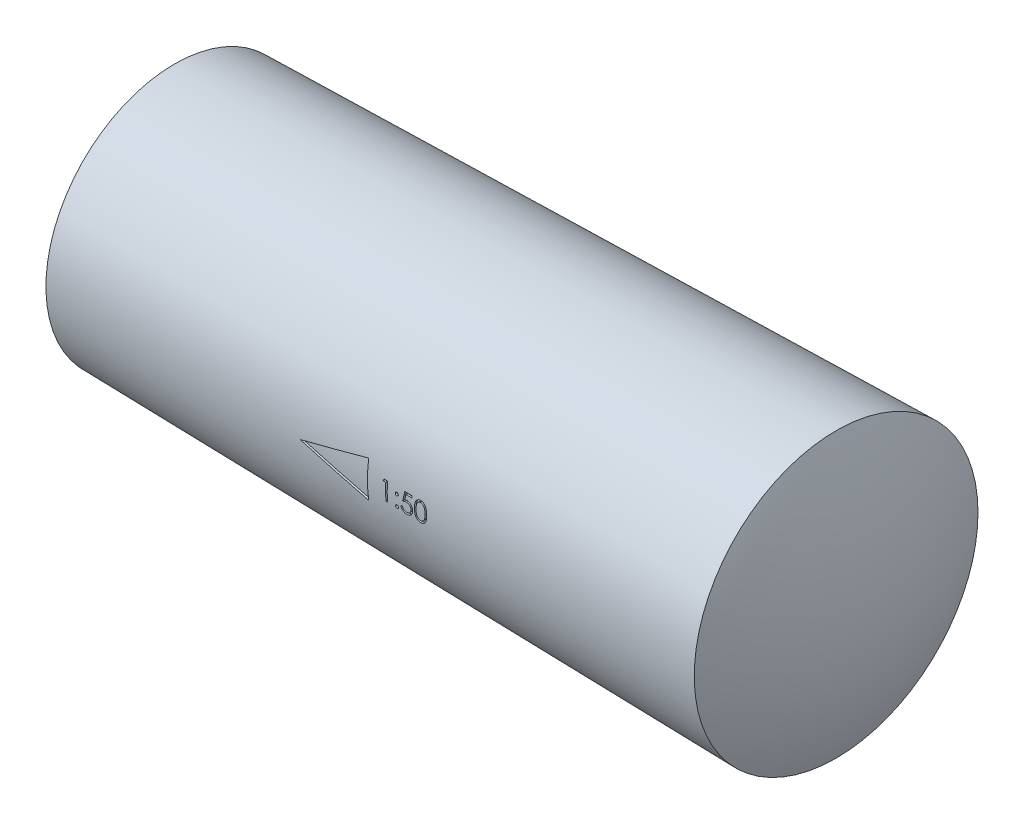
SolidWorks part; units mm, degrees
ref_plane "Front Plane" through (0, 0, 0) normal (0, 0, 1) x (1, 0, 0)
ref_plane "Top Plane" through (0, 0, 0) normal (0, 1, 0) x (1, 0, 0)
ref_plane "Right Plane" through (0, 0, 0) normal (1, 0, 0) x (0, 0, -1)
sketch "Sketch1" plane through (0, 0, 0) normal (1, 0, 0) x (0, 0, -1)
  circle A0 centre (0, 0) radius 7
  dimension "D1" = 14
extrude "Extrude1" add sketch "Sketch1" along normal mid plane 36
draft "Draft1" type of draft neutral plane draft angle 1.146 faces to draft 1 parameters "D1"=1.146
sketch "Sketch2" plane through (0, 0, 0) normal (0, 0, 1) x (1, 0, 0)
  line L0 (-18, 0) -> (-18, 7)
  line L1 (-18, 7) -> (-18, -7) construction
  line L2 (-18, 0) -> (-19.6, 0)
  line L3 (-19.6, 0) -> (-19.6, -7.36) construction
  line L4 (18, 0) -> (18, 7.72)
  line L5 (18, -7.72) -> (18, 7.72) construction
  line L6 (18, 0) -> (19.6, 0)
  line L7 (19.6, 0) -> (19.6, -7.36) construction
  line L8 (-18, -7) -> (18, -7.72) construction
  arc A0 (-19.6, 0) -> (-18, 7) centre (-3.4875, 0) cw
  arc A1 (19.6, 0) -> (18, 7.72) centre (0.1754, 0) ccw
  point P14 (0, -7.36)
revolve "Revolve1" add sketch "Sketch2" angle 360 about L2
sketch "Sketch5" plane through (0, 0, 0) normal (0, 0, 1) x (1, 0, 0)
  line L0 (0, 7.36) -> (0, -7.36) construction
  line L1 (18, 7.72) -> (-18, 7) construction
  line L2 (-18, -7) -> (18, -7.72) construction
ref_plane "Plane2" through (0, 0, 0) normal (-0.02, 0, 0.9998) x (0.9998, 0, 0.02)
sketch "Sketch6" plane through (0, 0, 0) normal (-0.02, 0, 0.9998) x (0.9998, 0, 0.02)
  line L0 (0, 0) -> (0, 1)
  line L1 (0, 7.36) -> (0, -7.36) construction
  line L2 (0, 1) -> (-3.7321, 0)
  line L3 (-3.7321, 0) -> (0, -1)
  line L4 (0, -1) -> (0, 0)
  line L5 (0, -0.5) -> (4, -0.5) construction
  text T0 "1:50" font "Century Gothic" height 1
  dimension "D1" = 2
  dimension "D2" = 30
  dimension "D3" = 4
wrap "Wrap2" sketch "Sketch6" wrap type deboss source sketch "Sketch6" thickness 0.1 parameters "D1"=0.1
equation "\"D2@Sketch2\" = \"D1@Sketch2\""
